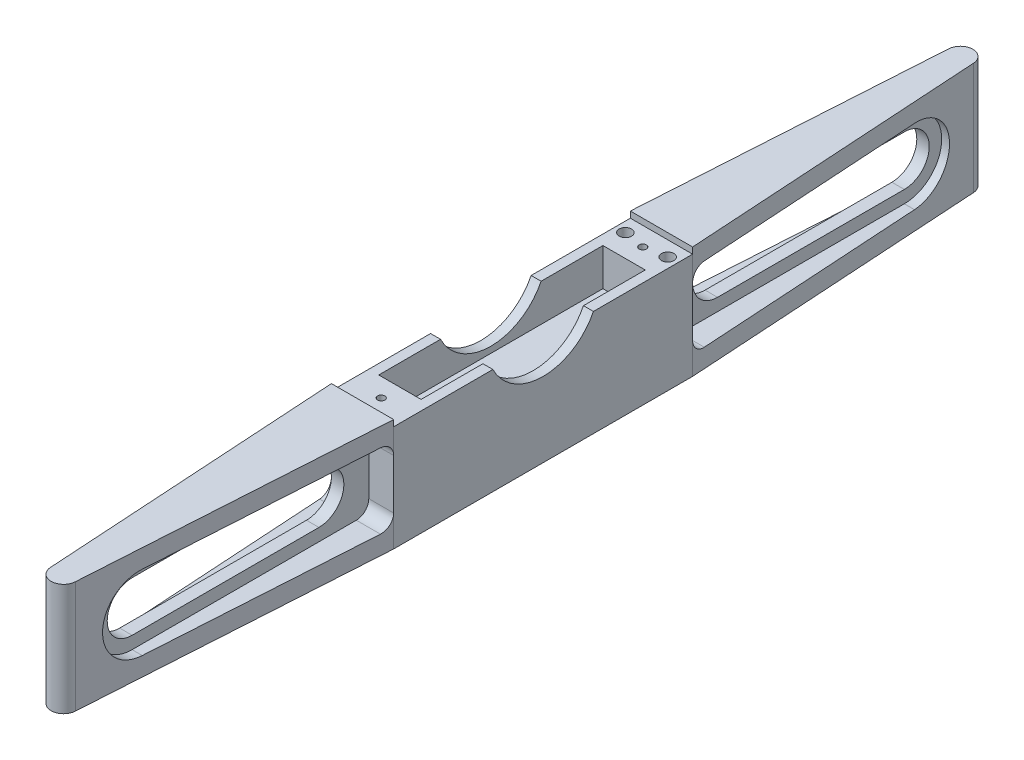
SolidWorks part; units mm, degrees
ref_plane "Front" through (0, 0, 0) normal (0, 0, 1) x (1, 0, 0)
ref_plane "Top" through (0, 0, 0) normal (0, 1, 0) x (1, 0, 0)
ref_plane "Right" through (0, 0, 0) normal (1, 0, 0) x (0, 0, -1)
sketch "Sketch1" plane through (0, 0, 0) normal (0, 1, 0) x (1, 0, 0)
  line L0 (0, 0) -> (55.1982, 0) construction
  line L1 (0, 0) -> (0, 49.235) construction
  line L2 (7.9375, 38.1) -> (3.1688, 114.4978)
  line L3 (-7.9375, 38.1) -> (-3.1688, 114.4978)
  line L4 (7.9375, 38.1) -> (7.9375, -38.1)
  line L5 (-7.9375, 38.1) -> (-7.9375, -38.1)
  line L6 (-7.9375, -38.1) -> (-3.1688, -114.4978)
  line L7 (7.9375, -38.1) -> (3.1688, -114.4978)
  arc A0 (-3.1688, 114.4978) -> (3.1688, 114.4978) centre (0, 114.3) cw
  arc A1 (-3.1688, -114.4978) -> (3.1688, -114.4978) centre (0, -114.3) ccw
  point P15 (-7.9375, 0)
  point P16 (7.9375, 0)
  dimension "D2" = 3.175
  dimension "D1" = 228.6
  dimension "D3" = 76.2
  dimension "D4" = 15.875
extrude "Base-Extrude" add sketch "Sketch1" along normal blind 28.575
sketch "Sketch2" plane through (7.9375, 0, 0) normal (1, 0, 0) x (0, 0, -1)
  line L0 (-38.1, 14.2875) -> (-127.9941, 14.2875) construction
  line L1 (-38.1, 28.575) -> (-38.1, 0) construction
  line L2 (-38.1, 4.7625) -> (-98.425, 4.7625)
  line L3 (-38.1, 23.8125) -> (-98.425, 23.8125)
  line L4 (-117.475, 28.575) -> (-117.475, 0) construction
  line L5 (-38.1, 23.8125) -> (-38.1, 4.7625)
  arc A0 (-98.425, 4.7625) -> (-98.425, 23.8125) centre (-98.425, 14.2875) cw
  dimension "D1" = 9.525
  dimension "D2" = 19.05
extrude "Cut-Extrude1" cut sketch "Sketch2" against normal blind 6.35
fillet "Fillet1" radius 3.175 2 edges at (4.7625, 23.8125, 38.1) (4.7625, 4.7625, 38.1)
mirror "Mirror1" about plane through (0, 0, 0) normal (1, 0, 0) of "Fillet1", "Cut-Extrude1"
mirror "Mirror2" about plane through (0, 0, 0) normal (0, 0, 1) of "Mirror1", "Cut-Extrude1", "Fillet1"
sketch "Sketch3" plane through (1.5875, 0, 0) normal (1, 0, 0) x (0, 0, -1)
  line L0 (-38.1, 20.6375) -> (-38.1, 7.9375) construction
  line L2 (-41.275, 20.6375) -> (-98.425, 20.6375)
  line L3 (-41.275, 7.9375) -> (-98.425, 7.9375)
  line L4 (-50.8, 20.6375) -> (-98.425, 20.6375)
  line L5 (-50.8, 7.9375) -> (-98.425, 7.9375)
  arc A0 (-50.8, 20.6375) -> (-50.8, 7.9375) centre (-50.8, 14.2875) cw
  arc A1 (-98.425, 20.6375) -> (-98.425, 7.9375) centre (-98.425, 14.2875) ccw
  arc A2 (-98.425, 20.6375) -> (-98.425, 7.9375) centre (-98.425, 14.2875) ccw
  dimension "D2" = 12.7
  dimension "D1" = 3.175
extrude "Cut-Extrude2" cut sketch "Sketch3" against normal through all
mirror "Mirror3" about plane through (0, 0, 0) normal (0, 0, 1) of "Cut-Extrude2"
sketch "Sketch5" plane through (0, 28.575, 0) normal (0, 1, 0) x (-1, 0, 0)
  line L0 (7.9375, 38.1) -> (-7.9375, 38.1)
  line L1 (7.9375, 38.1) -> (7.9375, -38.1)
  line L2 (-7.9375, -38.1) -> (7.9375, -38.1)
  line L3 (-7.9375, -38.1) -> (-7.9375, 38.1)
  line L4 (0, 0) -> (0, -42.9632) construction
  line L5 (7.9375, -38.1) -> (7.9375, 38.1) construction
  line L6 (-7.9375, -38.1) -> (-7.9375, 38.1) construction
extrude "Cover Cutout" cut sketch "Sketch5" against normal blind 1.5875
sketch "Sketch6" plane through (0, 26.9875, 0) normal (0, 1, 0) x (-1, 0, 0)
  line L0 (7.9375, 0) -> (-28.7818, 0) construction
  line L1 (-7.9375, -38.1) -> (-7.9375, 38.1) construction
  line L2 (-5.3975, -28.575) -> (-5.3975, 28.575)
  line L3 (5.3975, 38.1) -> (5.3975, -38.1)
  line L4 (5.3975, 28.575) -> (5.3975, -28.575)
  line L5 (7.9375, 38.1) -> (7.9375, -38.1) construction
  line L6 (5.3975, 28.575) -> (-5.3975, 28.575)
  line L7 (5.3975, -28.575) -> (-5.3975, -28.575)
  dimension "D1" = 2.54
  dimension "D3" = 57.15
  dimension "D2" = 2.54
extrude "Cut-Extrude4" cut sketch "Sketch6" against normal blind 9.525
sketch "Sketch7" plane through (7.9375, 0, 0) normal (1, 0, 0) x (0, 0, -1)
  line L0 (28.575, 17.4625) -> (-28.575, 17.4625) construction
  circle A0 centre (0, 33.3375) radius 14.3002
  dimension "D1" = 28.6004
  dimension "D2" = 15.875
extrude "Cut-Extrude5" cut sketch "Sketch7" against normal through all
sketch "Sketch8" plane through (0, 26.9875, 0) normal (0, 1, 0) x (-1, 0, 0)
  line L0 (0, 0) -> (-7.9375, 0) construction
  line L1 (-5.3975, 0) -> (-7.9375, 0) construction
  line L2 (0, 0) -> (0, -23.9678) construction
  circle A0 centre (0, -33.3375) radius 0.9271
  circle A1 centre (0, 33.3375) radius 0.9271
  dimension "D1" = 1.8542
  dimension "D2" = 66.675
extrude "Cut-Extrude6" cut sketch "Sketch8" against normal blind 12.7
hole_wizard "1/8 (0.125) Diameter Hole1" positions "Sketch10" profile "Sketch9" hole size "1/8" standard "Ansi Inch"
sketch "Sketch10" plane through (0, 26.9875, 0) normal (0, 1, 0) x (-1, 0, 0)
  line L0 (-7.9375, -38.1) -> (7.9375, -38.1) construction
  line L1 (-7.9375, -38.1) -> (-7.9375, -12.813) construction
  line L2 (0, -38.1) -> (0, -28.575) construction
  line L3 (5.3975, -28.575) -> (-5.3975, -28.575) construction
  point P0 (-5.3975, -34.29)
  point P11 (5.3975, -34.29)
  dimension "D1" = 3.81
  dimension "D2" = 2.54
sketch "Sketch9" plane through (5.3975, 26.9875, -34.29) normal (1, 0, 0) x (0, 0, 1)
  line L0 (0, 0) -> (0, 26.9875)
  line L1 (0, 26.9875) -> (1.5875, 26.9875)
  line L2 (1.5875, 26.9875) -> (1.5875, 0)
  line L5 (1.5875, 0) -> (0, 0)
  line L11 (0, -6.35) -> (0, 107.95) construction
  dimension "Thru Hole Dia." = 3.175
  dimension "Thru Hole Depth" = 26.9875
